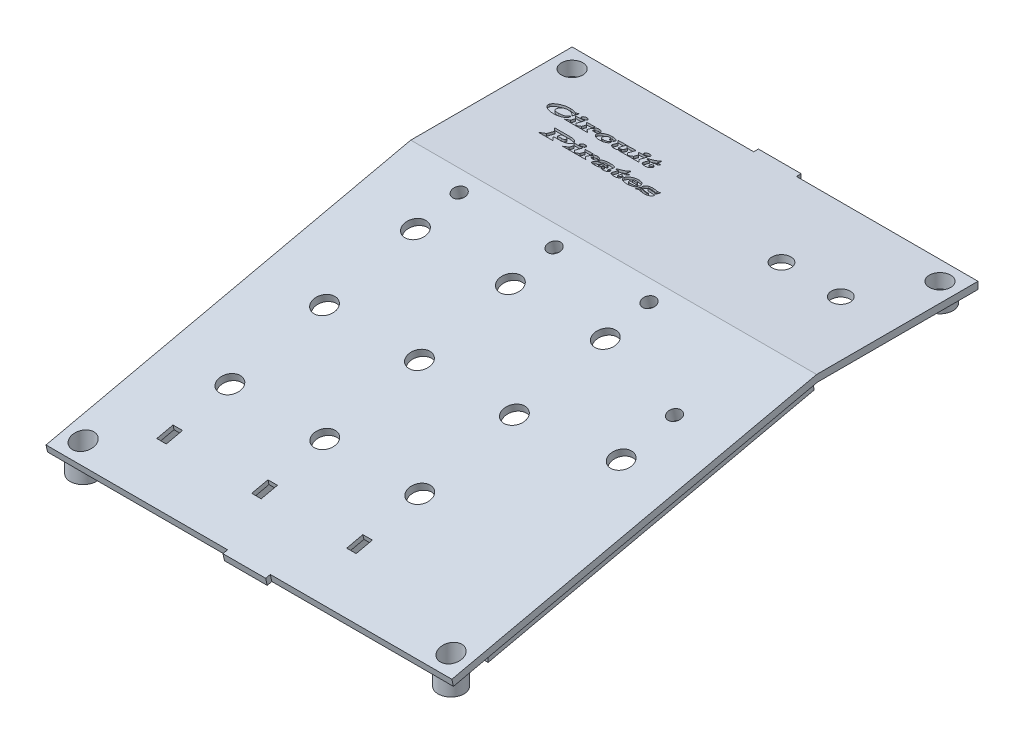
SolidWorks part; units mm, degrees
ref_plane "Front Plane" through (0, 0, 0) normal (0, 0, 1) x (1, 0, 0)
ref_plane "Top Plane" through (0, 0, 0) normal (0, 1, 0) x (1, 0, 0)
ref_plane "Right Plane" through (0, 0, 0) normal (1, 0, 0) x (0, 0, -1)
sketch "Sketch1" plane through (0, 0, 0) normal (1, 0, 0) x (0, 0, -1)
  line L0 (0, 0) -> (0, 3)
  line L1 (0, 3) -> (-68, 3)
  line L2 (-68, 3) -> (-221.6716, -31.3778)
  line L3 (-221.6716, -31.3778) -> (-221.0167, -34.3055)
  line L4 (-221.0167, -34.3055) -> (-67.6685, 0)
  line L5 (-67.6685, 0) -> (0, 0)
  dimension "D1" = 3
  dimension "D2" = 3
  dimension "D3" = 68
  dimension "D4" = 157.47
  dimension "D5" = 167.39
extrude "Boss-Extrude1" add sketch "Sketch1" against normal blind 171
sketch "Sketch2" plane through (0, 17.3443, 3.8801) normal (0, 0.9759, 0.2183) x (1, 0, 0)
  line L0 (-171, -223.1748) -> (0, -223.1748) construction
  line L1 (-94.5, -223.1748) -> (-76.5, -223.1748)
  line L2 (-94.5, -223.1748) -> (-94.5, -225.1748)
  line L3 (-94.5, -225.1748) -> (-76.5, -225.1748)
  line L4 (-76.5, -223.1748) -> (-76.5, -225.1748)
  line L5 (-94.5, -223.1748) -> (-171, -223.1748) construction
  line L6 (-76.5, -223.1748) -> (0, -223.1748) construction
  dimension "D1" = 18
  dimension "D2" = 2
extrude "Boss-Extrude2" add sketch "Sketch2" against normal blind 3
sketch "Sketch3" plane through (0, 3, 0) normal (0, 1, 0) x (1, 0, 0)
  line L0 (-171, 0) -> (0, 0) construction
  line L1 (-94.5, 0) -> (-76.5, 0)
  line L2 (-94.5, 0) -> (-94.5, 2)
  line L3 (-94.5, 2) -> (-76.5, 2)
  line L4 (-76.5, 0) -> (-76.5, 2)
  line L5 (-94.5, 0) -> (-171, 0) construction
  line L6 (-76.5, 0) -> (0, 0) construction
  dimension "D1" = 18
  dimension "D2" = 2
extrude "Boss-Extrude3" add sketch "Sketch3" against normal blind 3
sketch "Sketch4" plane through (0, 14.4166, 3.2251) normal (0, -0.9759, -0.2183) x (1, 0, 0)
  line L16 (-1, 67.0363) -> (-1, 222.1748)
  line L17 (-1, 222.1748) -> (-77.5, 222.1748)
  line L18 (-77.5, 222.1748) -> (-77.5, 224.1748)
  line L19 (-77.5, 224.1748) -> (-93.5, 224.1748)
  line L20 (-93.5, 224.1748) -> (-93.5, 222.1748)
  line L21 (-93.5, 222.1748) -> (-170, 222.1748)
  line L22 (-170, 222.1748) -> (-170, 67.0363)
  line L23 (-170, 67.0363) -> (-1, 67.0363)
  line L24 (-1, 67.0363) -> (-1, 222.1748)
  line L25 (-1, 222.1748) -> (-77.5, 222.1748)
  line L26 (-77.5, 222.1748) -> (-77.5, 224.1748)
  line L27 (-77.5, 224.1748) -> (-93.5, 224.1748)
  line L28 (-93.5, 224.1748) -> (-93.5, 222.1748)
  line L29 (-93.5, 222.1748) -> (-170, 222.1748)
  line L30 (-170, 222.1748) -> (-170, 67.0363)
  line L31 (-170, 67.0363) -> (-1, 67.0363)
  dimension "D1" = 1
extrude "Boss-Extrude4" add sketch "Sketch4" along normal blind 3
sketch "Sketch6" plane through (-93.5, 0, 0) normal (-1, 0, 0) x (0, 0, 1)
  line L0 (220.0408, -34.0872) -> (219.3859, -37.0148)
  line L1 (219.3859, -37.0148) -> (221.3376, -37.4514)
  line L2 (221.3376, -37.4514) -> (221.9926, -34.5238)
  line L3 (221.9926, -34.5238) -> (220.0408, -34.0872)
extrude "Cut-Extrude1" cut sketch "Sketch6" against normal up to surface (16 mm away)
sketch "Sketch7" plane through (-170, 0, 0) normal (-1, 0, 0) x (0, 0, 1)
  line L4 (220.0408, -34.0872) -> (205.4026, -30.8125)
  line L5 (220.0408, -34.0872) -> (68.6444, -0.2183) construction
  line L6 (205.4026, -30.8125) -> (205.4026, -33.8866)
  line L7 (219.3859, -37.0148) -> (67.9895, -3.1459) construction
  line L8 (205.4026, -33.8866) -> (219.3859, -37.0148)
  line L9 (219.3859, -37.0148) -> (220.0408, -34.0872)
  dimension "D1" = 15
extrude "Cut-Extrude2" cut sketch "Sketch7" against normal up to surface (169 mm away)
sketch "Sketch8" plane through (0, 11.489, 2.5702) normal (0, -0.9759, -0.2183) x (1, 0, 0)
  line L8 (-1, 207.8459) -> (-170, 207.8459) construction
  line L9 (-168, 207.8459) -> (-3, 207.8459)
  line L10 (-168, 207.8459) -> (-168, 67.0363)
  line L11 (-168, 67.0363) -> (-3, 67.0363)
  line L12 (-3, 207.8459) -> (-3, 67.0363)
  line L13 (-170, 67.0363) -> (-1, 67.0363) construction
  line L14 (-1, 67.0363) -> (-1, 207.8459) construction
  line L15 (-170, 207.8459) -> (-170, 67.0363) construction
  dimension "D1" = 2
  dimension "D2" = 2
extrude "Cut-Extrude3" cut sketch "Sketch8" against normal up to surface (3 mm away)
sketch "Sketch9" plane through (0, 0, 0) normal (0, -1, 0) x (1, 0, 0)
  line L0 (0, 67.6685) -> (0, 0) construction
  line L1 (-76.5, 0) -> (0, 0) construction
  line L2 (-171, 0) -> (-94.5, 0) construction
  line L3 (-171, 67.6685) -> (-171, 0) construction
  circle A0 centre (-163, 8) radius 5.5
  circle A1 centre (-8, 8) radius 5.5
  dimension "D1" = 11
  dimension "D2" = 8
  dimension "D3" = 8
  dimension "D4" = 8
  dimension "D5" = 8
extrude "Boss-Extrude5" add sketch "Sketch9" along normal blind 5
sketch "Sketch10" plane through (0, -5, 0) normal (0, -1, 0) x (1, 0, 0)
  circle A0 centre (-8, 8) radius 4.5
  circle A1 centre (-163, 8) radius 4.5
  dimension "D2" = 9
extrude "Cut-Extrude4" cut sketch "Sketch10" against normal up to surface (8 mm away)
sketch "Sketch11" plane through (0, -5, 0) normal (0, -1, 0) x (1, 0, 0)
  circle A0 centre (-8, 8) radius 5.5
  circle A1 centre (-163, 8) radius 5.5
  dimension "D1" = 11
extrude "Boss-Extrude6" add sketch "Sketch11" against normal blind 2
sketch "Sketch12" plane through (0, -5, 0) normal (0, -1, 0) x (1, 0, 0)
  circle A0 centre (-8, 8) radius 2
  circle A1 centre (-163, 8) radius 2
  dimension "D1" = 4
extrude "Cut-Extrude5" cut sketch "Sketch12" against normal up to surface (2 mm away)
sketch "Sketch13" plane through (0, 0, 0) normal (0, -1, 0) x (1, 0, 0)
  line L0 (-171, 221.0167) -> (-171, 67.6685) construction
  line L1 (0, 221.0167) -> (0, 67.6685) construction
  line L2 (-76.5, 221.0167) -> (0, 221.0167) construction
  line L3 (-171, 221.0167) -> (-94.5, 221.0167) construction
  circle A0 centre (-163, 214.0167) radius 5.5
  circle A1 centre (-8, 214.0167) radius 5.5
  dimension "D5" = 11
  dimension "D1" = 8
  dimension "D2" = 8
  dimension "D3" = 7
  dimension "D4" = 7
extrude "Boss-Extrude7" add sketch "Sketch13" along normal blind 41.81
sketch "Sketch14" plane through (0, 0, 0) normal (0, 1, 0) x (1, 0, 0)
  circle A0 centre (-163, -214.0167) radius 5.5
  circle A1 centre (-8, -214.0167) radius 5.5
  dimension "D1" = 11
extrude "Cut-Extrude6" cut sketch "Sketch14" against normal up to surface (30.8958 mm away)
sketch "Sketch15" plane through (0, -41.81, 0) normal (0, -1, 0) x (1, 0, 0)
  circle A0 centre (-163, 214.0167) radius 4.5
  circle A1 centre (-8, 214.0167) radius 4.5
  dimension "D1" = 9
extrude "Cut-Extrude7" cut sketch "Sketch15" against normal up to surface (13.1513 mm away)
sketch "Sketch16" plane through (0, -41.81, 0) normal (0, -1, 0) x (1, 0, 0)
  circle A0 centre (-8, 214.0167) radius 5.5
  circle A1 centre (-163, 214.0167) radius 5.5
  dimension "D1" = 11
extrude "Boss-Extrude8" add sketch "Sketch16" against normal blind 2
sketch "Sketch18" plane through (0, 14.4166, 3.2251) normal (0, -0.9759, -0.2183) x (1, 0, 0)
  line L0 (-171, 65.7048) -> (0, 65.7048) construction
  line L1 (-157, 70.7048) -> (-153, 70.7048)
  line L2 (-157, 70.7048) -> (-157, 215.1748)
  line L3 (-157, 215.1748) -> (-153, 215.1748)
  line L4 (-153, 70.7048) -> (-153, 215.1748)
  line L5 (-171, 223.1748) -> (-94.5, 223.1748) construction
  line L6 (-171, 65.7048) -> (-171, 223.1748) construction
  line L8 (-117, 70.7048) -> (-113, 70.7048)
  line L9 (-117, 70.7048) -> (-117, 215.1748)
  line L10 (-117, 215.1748) -> (-113, 215.1748)
  line L11 (-113, 70.7048) -> (-113, 215.1748)
  line L12 (-77, 70.7048) -> (-73, 70.7048)
  line L13 (-77, 70.7048) -> (-77, 215.1748)
  line L14 (-77, 215.1748) -> (-73, 215.1748)
  line L15 (-73, 70.7048) -> (-73, 215.1748)
  line L16 (-37, 70.7048) -> (-33, 70.7048)
  line L17 (-37, 70.7048) -> (-37, 215.1748)
  line L18 (-37, 215.1748) -> (-33, 215.1748)
  line L19 (-33, 70.7048) -> (-33, 215.1748)
  dimension "D1" = 4
  dimension "D2" = 5
  dimension "D3" = 8
  dimension "D4" = 14
  dimension "D5" = 36
  dimension "D6" = 36
  dimension "D7" = 36
sketch "Sketch23" plane through (0, -41.81, 0) normal (0, -1, 0) x (1, 0, 0)
  circle A0 centre (-163, 214.0167) radius 2
  circle A1 centre (-8, 214.0167) radius 2
  dimension "D1" = 4
extrude "Cut-Extrude14" cut sketch "Sketch23" against normal up to surface (2 mm away)
extrude "Boss-Extrude9" add sketch "Sketch18" along normal blind 1.5
sketch "Sketch19" plane through (0, 12.9528, 2.8977) normal (0, -0.9759, -0.2183) x (1, 0, 0)
  line L0 (-33, 70.7048) -> (-33, 215.1748) construction
  line L1 (-37, 215.1748) -> (-33, 215.1748)
  line L2 (-37, 215.1748) -> (-37, 153.7048)
  line L3 (-37, 153.7048) -> (-33, 153.7048)
  line L4 (-33, 215.1748) -> (-33, 153.7048)
  line L5 (-37, 70.7048) -> (-33, 70.7048) construction
  line L6 (-157, 70.7048) -> (-153, 70.7048) construction
  line L7 (-156, 70.7048) -> (-154, 70.7048)
  line L8 (-156, 70.7048) -> (-156, 215.1748)
  line L9 (-156, 215.1748) -> (-154, 215.1748)
  line L10 (-154, 70.7048) -> (-154, 215.1748)
  line L11 (-153, 215.1748) -> (-157, 215.1748) construction
  line L12 (-117, 70.7048) -> (-113, 70.7048) construction
  line L13 (-116, 70.7048) -> (-114, 70.7048)
  line L14 (-116, 70.7048) -> (-116, 215.1748)
  line L15 (-116, 215.1748) -> (-114, 215.1748)
  line L16 (-114, 70.7048) -> (-114, 215.1748)
  line L17 (-113, 215.1748) -> (-117, 215.1748) construction
  line L18 (-77, 70.7048) -> (-73, 70.7048) construction
  line L19 (-76, 70.7048) -> (-74, 70.7048)
  line L20 (-76, 70.7048) -> (-76, 215.1748)
  line L21 (-76, 215.1748) -> (-74, 215.1748)
  line L22 (-74, 70.7048) -> (-74, 215.1748)
  line L23 (-73, 215.1748) -> (-77, 215.1748) construction
  line L29 (-157, 215.1748) -> (-157, 70.7048) construction
  line L30 (-117, 215.1748) -> (-117, 70.7048) construction
  line L31 (-77, 215.1748) -> (-77, 70.7048) construction
  point P10 (-35, 70.7048)
  dimension "D1" = 83
  dimension "D2" = 2
  dimension "D4" = 1
  dimension "D5" = 1
  dimension "D6" = 1
extrude "Cut-Extrude10" cut sketch "Sketch19" against normal up to surface (1.5 mm away)
sketch "Sketch20" plane through (0, 12.9528, 2.8977) normal (0, -0.9759, -0.2183) x (1, 0, 0)
  line L0 (-37, 153.7048) -> (-33, 153.7048) construction
  line L1 (-36, 153.7048) -> (-34, 153.7048)
  line L2 (-36, 153.7048) -> (-36, 70.7048)
  line L3 (-36, 70.7048) -> (-34, 70.7048)
  line L4 (-34, 153.7048) -> (-34, 70.7048)
  line L5 (-37, 70.7048) -> (-33, 70.7048) construction
  line L6 (-37, 153.7048) -> (-37, 70.7048) construction
  dimension "D1" = 2
  dimension "D2" = 1
extrude "Cut-Extrude11" cut sketch "Sketch20" against normal up to surface (1.5 mm away)
sketch "Sketch21" plane through (0, 14.4166, 3.2251) normal (0, -0.9759, -0.2183) x (1, 0, 0)
  line L0 (-156, 70.7048) -> (-156, 215.1748) construction
  line L1 (-116, 70.7048) -> (-116, 215.1748) construction
  line L2 (-171, 223.1748) -> (-94.5, 223.1748) construction
  line L3 (-76, 70.7048) -> (-76, 215.1748) construction
  circle A0 centre (-143.3, 172.1748) radius 4.5
  circle A1 centre (-143.3, 131.3148) radius 4.5
  circle A2 centre (-143.3, 92.0548) radius 4.5
  circle A3 centre (-103.3, 172.1748) radius 4.5
  circle A4 centre (-103.3, 131.3148) radius 4.5
  circle A5 centre (-103.3, 92.0548) radius 4.5
  circle A6 centre (-63.3, 92.0548) radius 4.5
  circle A7 centre (-63.3, 131.3148) radius 4.5
  circle A8 centre (-63.3, 172.1748) radius 4.5
  dimension "D2" = 9
  dimension "D1" = 12.7
  dimension "D3" = 51
  dimension "D4" = 12.7
  dimension "D5" = 12.7
  dimension "D6" = 40.86
  dimension "D7" = 39.26
extrude "Cut-Extrude12" cut sketch "Sketch21" against normal up to surface (3 mm away)
sketch "Sketch22" plane through (0, 14.4166, 3.2251) normal (0, -0.9759, -0.2183) x (1, 0, 0)
  line L0 (-36, 153.7048) -> (-36, 70.7048) construction
  line L1 (-34, 70.7048) -> (-33, 70.7048) construction
  circle A0 centre (-23.3, 126.2048) radius 4.5
  dimension "D1" = 9
  dimension "D2" = 55.5
  dimension "12.7" = 12.7
extrude "Cut-Extrude13" cut sketch "Sketch22" against normal up to surface (3 mm away)
sketch "Sketch24" plane through (0, 17.3443, 3.8801) normal (0, 0.9759, 0.2183) x (1, 0, 0)
  line L0 (-171, -223.1748) -> (-94.5, -223.1748) construction
  line L13 (-147.3, -187.1748) -> (-139.3, -187.1748)
  line L14 (-147.3, -187.1748) -> (-147.3, -209.1748)
  line L15 (-147.3, -209.1748) -> (-139.3, -209.1748)
  line L16 (-139.3, -187.1748) -> (-139.3, -209.1748)
  line L17 (-147.3, -187.1748) -> (-139.3, -209.1748) construction
  line L18 (-147.3, -209.1748) -> (-139.3, -187.1748) construction
  line L19 (-107.3, -187.1748) -> (-99.3, -187.1748)
  line L20 (-107.3, -187.1748) -> (-107.3, -209.1748)
  line L21 (-107.3, -209.1748) -> (-99.3, -209.1748)
  line L22 (-99.3, -187.1748) -> (-99.3, -209.1748)
  line L23 (-107.3, -187.1748) -> (-99.3, -209.1748) construction
  line L24 (-107.3, -209.1748) -> (-99.3, -187.1748) construction
  line L25 (-67.3, -187.1748) -> (-59.3, -187.1748)
  line L26 (-67.3, -187.1748) -> (-67.3, -209.1748)
  line L27 (-67.3, -209.1748) -> (-59.3, -209.1748)
  line L28 (-59.3, -187.1748) -> (-59.3, -209.1748)
  line L29 (-67.3, -187.1748) -> (-59.3, -209.1748) construction
  line L30 (-67.3, -209.1748) -> (-59.3, -187.1748) construction
  line L32 (-156, -70.7048) -> (-156, -215.1748) construction
  line L33 (-116, -70.7048) -> (-116, -215.1748) construction
  line L34 (-76, -70.7048) -> (-76, -215.1748) construction
  point P0 (-143.3, -198.1748)
  point P5 (-103.3, -198.1748)
  point P10 (-63.3, -198.1748)
  dimension "D1" = 22
  dimension "D2" = 8
  dimension "D3" = 25
  dimension "D4" = 12.7
  dimension "D5" = 12.7
  dimension "D6" = 12.7
extrude "Boss-Extrude10" add sketch "Sketch24" against normal blind 8
sketch "Sketch25" plane through (0, 9.5372, 2.1336) normal (0, -0.9759, -0.2183) x (1, 0, 0)
  line L8 (-140.3, 188.1748) -> (-140.3, 208.1748)
  line L9 (-140.3, 208.1748) -> (-146.3, 208.1748)
  line L10 (-146.3, 208.1748) -> (-146.3, 188.1748)
  line L11 (-146.3, 188.1748) -> (-140.3, 188.1748)
  line L12 (-140.3, 188.1748) -> (-140.3, 208.1748)
  line L13 (-140.3, 208.1748) -> (-146.3, 208.1748)
  line L14 (-146.3, 208.1748) -> (-146.3, 188.1748)
  line L15 (-146.3, 188.1748) -> (-140.3, 188.1748)
  line L20 (-100.3, 188.1748) -> (-100.3, 208.1748)
  line L21 (-100.3, 208.1748) -> (-106.3, 208.1748)
  line L22 (-106.3, 208.1748) -> (-106.3, 188.1748)
  line L23 (-106.3, 188.1748) -> (-100.3, 188.1748)
  line L24 (-100.3, 188.1748) -> (-100.3, 208.1748)
  line L25 (-100.3, 208.1748) -> (-106.3, 208.1748)
  line L26 (-106.3, 208.1748) -> (-106.3, 188.1748)
  line L27 (-106.3, 188.1748) -> (-100.3, 188.1748)
  line L32 (-60.3, 188.1748) -> (-60.3, 208.1748)
  line L33 (-60.3, 208.1748) -> (-66.3, 208.1748)
  line L34 (-66.3, 208.1748) -> (-66.3, 188.1748)
  line L35 (-66.3, 188.1748) -> (-60.3, 188.1748)
  line L36 (-60.3, 188.1748) -> (-60.3, 208.1748)
  line L37 (-60.3, 208.1748) -> (-66.3, 208.1748)
  line L38 (-66.3, 208.1748) -> (-66.3, 188.1748)
  line L39 (-66.3, 188.1748) -> (-60.3, 188.1748)
  dimension "D1" = 1
  dimension "D2" = 1
  dimension "D3" = 1
extrude "Cut-Extrude15" cut sketch "Sketch25" against normal offset from surface (6 mm away) 2
sketch "Sketch26" plane through (0, 15.3925, 3.4435) normal (0, -0.9759, -0.2183) x (1, 0, 0)
  line L0 (-143.3, 198.1748) -> (-143.3, 208.1748) construction
  line L1 (-61.3, 201.6748) -> (-65.3, 201.6748)
  line L2 (-61.3, 201.6748) -> (-61.3, 194.6748)
  line L3 (-61.3, 194.6748) -> (-65.3, 194.6748)
  line L4 (-65.3, 201.6748) -> (-65.3, 194.6748)
  line L5 (-61.3, 201.6748) -> (-65.3, 194.6748) construction
  line L6 (-61.3, 194.6748) -> (-65.3, 201.6748) construction
  line L7 (-105.3, 201.6748) -> (-101.3, 201.6748)
  line L8 (-105.3, 201.6748) -> (-105.3, 194.6748)
  line L9 (-105.3, 194.6748) -> (-101.3, 194.6748)
  line L10 (-101.3, 201.6748) -> (-101.3, 194.6748)
  line L11 (-105.3, 201.6748) -> (-101.3, 194.6748) construction
  line L12 (-105.3, 194.6748) -> (-101.3, 201.6748) construction
  line L13 (-145.3, 201.6748) -> (-141.3, 201.6748)
  line L14 (-145.3, 201.6748) -> (-145.3, 194.6748)
  line L15 (-145.3, 194.6748) -> (-141.3, 194.6748)
  line L16 (-141.3, 201.6748) -> (-141.3, 194.6748)
  line L17 (-145.3, 201.6748) -> (-141.3, 194.6748) construction
  line L18 (-145.3, 194.6748) -> (-141.3, 201.6748) construction
  line L19 (-140.3, 208.1748) -> (-146.3, 208.1748) construction
  line L20 (-143.3, 198.1748) -> (-143.3, 188.1748) construction
  line L21 (-146.3, 188.1748) -> (-140.3, 188.1748) construction
  line L22 (-146.3, 208.1748) -> (-146.3, 188.1748) construction
  line L23 (-106.3, 208.1748) -> (-106.3, 188.1748) construction
  line L24 (-66.3, 208.1748) -> (-66.3, 188.1748) construction
  point P0 (-63.3, 198.1748)
  point P5 (-103.3, 198.1748)
  point P10 (-143.3, 198.1748)
  dimension "D1" = 4
  dimension "D2" = 7
  dimension "D3" = 3
  dimension "D4" = 3
  dimension "D5" = 3
extrude "Cut-Extrude16" cut sketch "Sketch26" against normal up to surface (2 mm away)
sketch "Sketch27" plane through (0, 17.3443, 3.8801) normal (0, 0.9759, 0.2183) x (1, 0, 0)
  line L0 (-156, -70.7048) -> (-156, -215.1748) construction
  line L1 (-116, -70.7048) -> (-116, -215.1748) construction
  line L2 (-76, -70.7048) -> (-76, -215.1748) construction
  line L3 (-36, -70.7048) -> (-36, -153.7048) construction
  line L4 (-171, -223.1748) -> (-94.5, -223.1748) construction
  line L5 (-76.5, -223.1748) -> (0, -223.1748) construction
  circle A0 centre (-143.3, -73.1748) radius 4.5
  circle A1 centre (-103.3, -73.1748) radius 4.5
  circle A2 centre (-63.3, -73.1748) radius 4.5
  circle A3 centre (-23.3, -103.1748) radius 4.5
  dimension "D1" = 9
  dimension "D2" = 12.7
  dimension "D3" = 12.7
  dimension "D4" = 12.7
  dimension "D5" = 12.7
  dimension "D6" = 150
  dimension "D7" = 150
  dimension "D8" = 150
  dimension "D9" = 120
extrude "Boss-Extrude11" add sketch "Sketch27" against normal blind 5
sketch "Sketch28" plane through (0, 12.4649, 2.7885) normal (0, -0.9759, -0.2183) x (1, 0, 0)
  circle A0 centre (-143.3, 73.1748) radius 2.75
  circle A1 centre (-103.3, 73.1748) radius 2.75
  circle A2 centre (-63.3, 73.1748) radius 2.75
  circle A3 centre (-23.3, 103.1748) radius 2.75
  dimension "D1" = 5.5
extrude "Cut-Extrude17" cut sketch "Sketch28" against normal up to surface (5 mm away)
sketch "Sketch31" plane through (0, 0, 0) normal (0, -1, 0) x (1, 0, 0)
  line L3 (-76.5, 0) -> (0, 0) construction
  line L5 (0, 67.6685) -> (0, 0) construction
  circle A0 centre (-48.3, 34.5) radius 4
  circle A1 centre (-23.3, 34.5) radius 4
  dimension "D4" = 8
  dimension "D1" = 34.5
  dimension "D2" = 48.3
  dimension "D3" = 23.3
extrude "Cut-Extrude19" cut sketch "Sketch31" against normal up to surface (3 mm away)
sketch "Sketch35" plane through (0, 3, 0) normal (0, 1, 0) x (1, 0, 0)
  line L0 (-171, 0) -> (-171, -68) construction
  line L1 (-171, 0) -> (-94.5, 0) construction
  text T0 "<b><i>Circuit</i></b>      <b><i>Pirates</i></b>" font "Wide Latin" height 5
  dimension "D1" = 15
  dimension "D2" = 28
extrude "Cut-Extrude21" cut sketch "Sketch35" against normal blind 1
chamfer "Chamfer1" distance 1 angle 45 26 edges at (-143.3, -31.2491, 207.3544) (-147.3, -28.8476, 196.6197) (-143.3, -26.4462, 185.885) (-139.3, -28.8476, 196.6197) (-103.3, -26.4462, 185.885) (-107.3, -28.8476, 196.6197) (-103.3, -31.2491, 207.3544) (-99.3, -28.8476, 196.6197) (-63.3, -31.2491, 207.3544) (-67.3, -28.8476, 196.6197) (-63.3, -26.4462, 185.885) (-59.3, -28.8476, 196.6197) (-168, -15.5154, 137.0235) (-157, -16.7891, 142.717) (-153, -16.7891, 142.717) (-117, -16.7891, 142.717) (-113, -16.7891, 142.717) (-77, -16.7891, 142.717) (-73, -16.7891, 142.717) (-3, -15.5154, 137.0235) (-33, -10.0792, 112.7234) (-37, -10.0792, 112.7234) (-143.3, -0.576, 70.2434) (-103.3, -0.576, 70.2434) (-63.3, -0.576, 70.2434) (-23.3, -7.1254, 99.5198)
fillet "Fillet1" radius 1 4 edges at (-168.2727, -33.0896, 215.5814) (-163, 0, 2.5) (-8, 0, 2.5) (-8, -31.5091, 208.5167)
